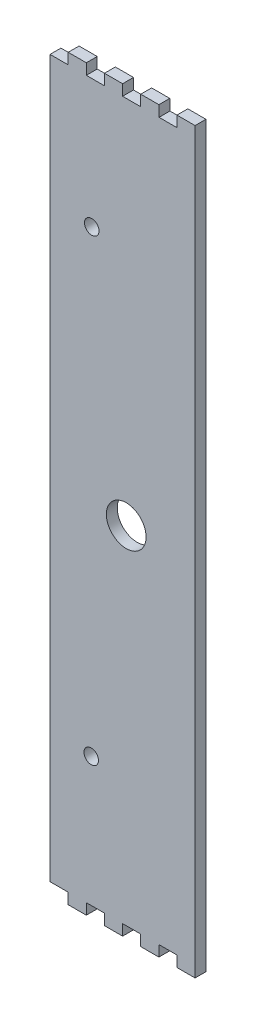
SolidWorks part; units mm, degrees
ref_plane "Piano frontale" through (0, 0, 0) normal (0, 0, 1) x (1, 0, 0)
ref_plane "Piano superiore" through (0, 0, 0) normal (0, 1, 0) x (1, 0, 0)
ref_plane "Piano destro" through (0, 0, 0) normal (1, 0, 0) x (0, 0, -1)
sketch "Schizzo1" plane through (0, 0, 0) normal (0, 0, 1) x (1, 0, 0)
  line L4 (-40, 110) -> (-40, -285)
  line L43 (40, 0) -> (-40, 0) construction
  line L44 (-20, -291) -> (-30, -291)
  line L45 (0, -291) -> (-10, -291)
  line L46 (20, -291) -> (10, -291)
  line L47 (29.95, -291) -> (30, -285)
  line L48 (30, -285) -> (20, -285)
  line L49 (20, -291) -> (20, -285)
  line L50 (10, -291) -> (10, -285)
  line L51 (10, -285) -> (0, -285)
  line L52 (0, -291) -> (0, -285)
  line L53 (-10, -291) -> (-10, -285)
  line L54 (-10, -285) -> (-20, -285)
  line L55 (-20, -291) -> (-20, -285)
  line L56 (-30, -291) -> (-30, -285)
  line L57 (-30, -285) -> (-40, -285)
  line L58 (-20, 116) -> (-30, 116)
  line L59 (20, 116) -> (10, 116)
  line L60 (-30, 110) -> (-40, 110)
  line L61 (-30, 116) -> (-30, 110)
  line L62 (-10, 110) -> (-20, 110)
  line L63 (-20, 116) -> (-20, 110)
  line L64 (-10, 116) -> (-10, 110)
  line L65 (10, 110) -> (0, 110)
  line L66 (0, 116) -> (0, 110)
  line L67 (10, 116) -> (10, 110)
  line L68 (20, 116) -> (20.1, 110)
  line L69 (30.1, 110) -> (20.1, 110)
  line L70 (29.95, 116) -> (30.1, 110)
  line L71 (0, 116) -> (-10, 116)
  line L72 (39.95, -291) -> (29.95, -291)
  line L73 (39.95, 116) -> (39.95, -291)
  line L74 (39.95, 116) -> (29.95, 116)
  dimension "D2" = 6
  dimension "D3" = 6
  dimension "D4" = 10
  dimension "D5" = 10
  dimension "D9" = 10
  dimension "D10" = 10
  dimension "D12" = 407
extrude "Estrusione-Estrusione1" add sketch "Schizzo1" along normal blind 6
extrude "Cut-Extrude1" cut sketch "Sketch1" against normal blind 6
sketch "Sketch1" plane through (-51.8858, -233.5453, 6) normal (0, 0, 1) x (0, 1, 0)
  circle A0 centre (19.7453, -34.5858) radius 4
extrude "Cut-Extrude3" cut sketch "Sketch3" against normal blind 10
sketch "Sketch3" plane through (-51.8858, 58.5453, 6) normal (0, 0, 1) x (0, 1, 0)
  line L0 (57.4547, -31.8858) -> (-152.5453, -31.8858)
  line L1 (-152.5453, -31.8858) -> (-152.5453, -53.8858)
  circle A0 centre (-152.5453, -53.8858) radius 10.95
extrude "Cut-Extrude4" cut sketch "Sketch4" against normal blind 6
sketch "Sketch4" plane through (-51.8858, -233.5453, 6) normal (0, 0, 1) x (0, 1, 0)
  circle A0 centre (272.6786, -34.878) radius 4
